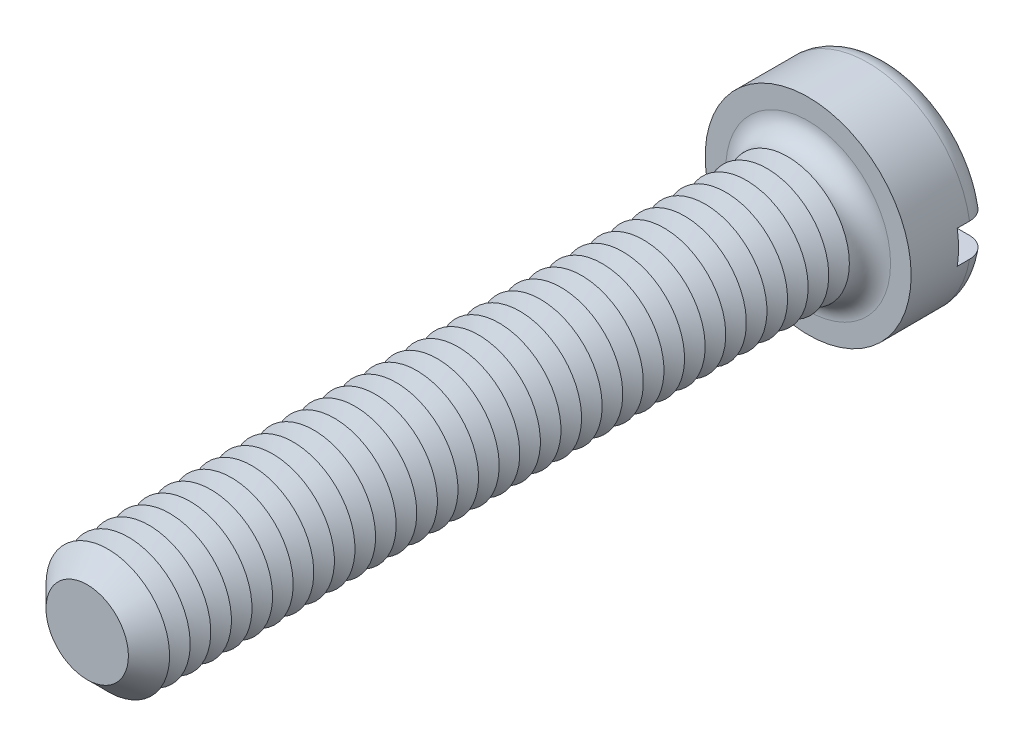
SolidWorks part; units mm, degrees
ref_plane "Front Plane" through (0, 0, 0) normal (0, 0, 1) x (1, 0, 0)
ref_plane "Top Plane" through (0, 0, 0) normal (0, 1, 0) x (1, 0, 0)
ref_plane "Right Plane" through (0, 0, 0) normal (1, 0, 0) x (0, 0, -1)
sketch "Sketch3" plane through (0, 0, 0) normal (0, 0, 1) x (1, 0, 0)
  circle A0 centre (0, 0) radius 5
  dimension "D1" = 10
extrude "Boss-Extrude2" add sketch "Sketch3" against normal blind 3.9
sketch "Sketch4" plane through (0, 0, 0) normal (0, 0, 1) x (1, 0, 0)
  circle A0 centre (0, 0) radius 3
  dimension "D1" = 6
extrude "Boss-Extrude3" add sketch "Sketch4" along normal blind 35
fillet "Fillet1" radius 1 2 edges at (5, 0, -3.9) (3, 0, 0)
chamfer "Chamfer1" distance 1 angle 45 1 edges at (3, 0, 35)
sketch "Sketch5" plane through (0, 0, 0) normal (1, 0, 0) x (0, 0, -1)
  line L0 (1.6944, 0) -> (-7.6738, 0) construction
sketch "Sketch6" plane through (0, 0, 0) normal (1, 0, 0) x (0, 0, -1)
  line L0 (-1, 3) -> (-1.5, 2.134)
  line L1 (-1.5, 2.134) -> (-2, 3)
  line L2 (-1, 3) -> (-34, 3) construction
  line L3 (-2, 3) -> (-1, 3)
  dimension "D1" = 1
revolve "Cut-Revolve1" cut sketch "Sketch6" angle 360 about L0
pattern_linear "LPattern1" count 33 spacing 1 along (0, 0, 1) of "Cut-Revolve1"
sketch "Sketch8" plane through (0, 0, -3.9) normal (0, 0, -1) x (-1, 0, 0)
  line L1 (5, -0.8) -> (-5, -0.8)
  line L2 (5, -0.8) -> (5, 0.8)
  line L3 (5, 0.8) -> (-5, 0.8)
  line L4 (-5, -0.8) -> (-5, 0.8)
  line L5 (5, -0.8) -> (-5, 0.8) construction
  line L6 (5, 0.8) -> (-5, -0.8) construction
  point P0 (0, 0)
  dimension "D1" = 10
  dimension "D2" = 1.6
extrude "Cut-Extrude1" cut sketch "Sketch8" against normal blind 1.6
